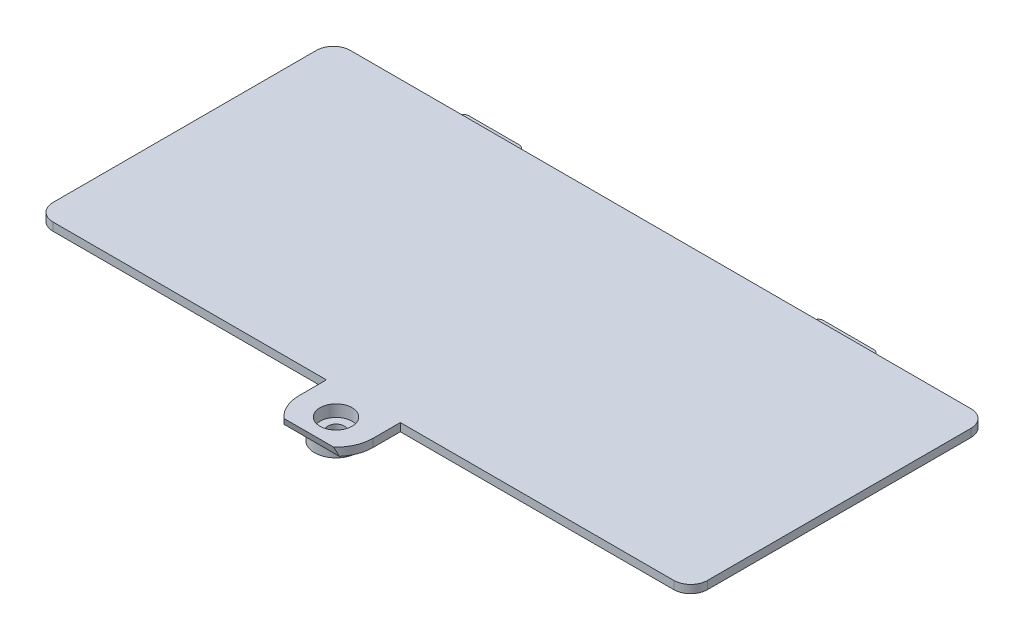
SolidWorks part; units mm, degrees
ref_plane "Plan de face" through (0, 0, 0) normal (0, 0, 1) x (1, 0, 0)
ref_plane "Plan de dessus" through (0, 0, 0) normal (0, 1, 0) x (1, 0, 0)
ref_plane "Plan de droite" through (0, 0, 0) normal (1, 0, 0) x (0, 0, -1)
sketch "Esquisse1" plane through (0, 0, 0) normal (0, 1, 0) x (1, 0, 0)
  line L0 (0, -16.1914) -> (0, 68.8201) construction
  line L1 (-24.9366, 0) -> (84.2046, 0) construction
  line L2 (-24.9366, 55.5) -> (84.2046, 55.5) construction
  line L3 (61.1, 68.8201) -> (61.1, -16.1914) construction
  line L4 (6.9, 12.8488) -> (6.9, -15.044) construction
  line L5 (22.2274, -5.1) -> (-43.2997, -5.1) construction
  line L6 (6.9, -5.1) -> (6.9, 0)
  line L7 (6.9, 0) -> (57.95, 0)
  line L8 (61.1, 3.15) -> (61.1, 52.35)
  line L9 (57.95, 55.5) -> (-57.95, 55.5)
  line L10 (-6.9, -5.1) -> (-6.9, 0)
  line L11 (-6.9, 0) -> (-57.95, 0)
  line L12 (-61.1, 3.15) -> (-61.1, 52.35)
  arc A0 (-6.9, -5.1) -> (6.9, -5.1) centre (0, -5.1) ccw
  arc A1 (61.1, 52.35) -> (57.95, 55.5) centre (57.95, 52.35) ccw
  arc A2 (57.95, 0) -> (61.1, 3.15) centre (57.95, 3.15) ccw
  arc A3 (-57.95, 0) -> (-61.1, 3.15) centre (-57.95, 3.15) cw
  arc A4 (-61.1, 52.35) -> (-57.95, 55.5) centre (-57.95, 52.35) cw
  circle A5 centre (0, -5.1) radius 1.5
  point P21 (61.1, 55.5)
  point P24 (61.1, 0)
  point P32 (0, 55.5)
  dimension "D2" = 61.1
  dimension "D4" = 3.15
  dimension "D5" = 6.9
  dimension "D1" = 5.1
  dimension "D3" = 55.5
extrude "Boss.-Extru.1" add sketch "Esquisse1" along normal blind 1.5
ref_plane "Plan1" through (0, 0, 0) normal (1, 0, 0) x (0, 0, -1)
sketch "Esquisse2" plane through (0, 0, 0) normal (0, -1, 0) x (1, 0, 0)
  line L0 (-61.1, -64.4737) -> (-61.1, 17.4142) construction
  line L1 (-69.9262, 0) -> (78.2262, 0) construction
  line L2 (-69.9262, -55.5) -> (78.2262, -55.5) construction
  line L3 (61.1, -64.4737) -> (61.1, 17.4142) construction
  line L4 (-59.1, 13.5084) -> (-59.1, -64.4737) construction
  line L5 (-69.9262, -52.2) -> (78.2262, -52.2) construction
  line L6 (78.2262, -2) -> (-69.9262, -2) construction
  line L7 (59.1, 13.5084) -> (59.1, -64.4737) construction
  line L8 (0, -63.5309) -> (0, 25.3606) construction
  line L9 (-15, 25.3606) -> (-15, -63.5309) construction
  line L10 (-16.5, -63.5309) -> (-16.5, 25.3606) construction
  line L11 (-46.5, 25.3606) -> (-46.5, -63.5309) construction
  line L12 (-48, 25.3606) -> (-48, -63.5309) construction
  line L13 (-69.9262, -27.1) -> (79.5731, -27.1) construction
  line L14 (68.6637, -11.35) -> (-69.9262, -11.35) construction
  line L15 (-69.9262, -9.85) -> (68.6637, -9.85) construction
  line L16 (68.6637, -26.35) -> (-69.9262, -26.35) construction
  line L17 (-59.1, -26.35) -> (-48, -26.35)
  line L18 (-48, -2) -> (-46.5, -2)
  line L19 (-48, -2) -> (-48, -9.85)
  line L20 (-48, -52.2) -> (-46.5, -52.2)
  line L21 (-46.5, -2) -> (-46.5, -9.85)
  line L22 (-16.5, -2) -> (-15, -2)
  line L23 (-16.5, -2) -> (-16.5, -9.85)
  line L24 (-16.5, -52.2) -> (-15, -52.2)
  line L25 (-15, -2) -> (-15, -9.85)
  line L26 (-59.1, -9.85) -> (-48, -9.85)
  line L27 (-59.1, -9.85) -> (-59.1, -11.35)
  line L28 (-59.1, -11.35) -> (-48, -11.35)
  line L29 (59.1, -9.85) -> (59.1, -11.35)
  line L30 (15, -2) -> (15, -9.85)
  line L31 (16.5, -52.2) -> (15, -52.2)
  line L32 (16.5, -2) -> (16.5, -9.85)
  line L33 (16.5, -2) -> (15, -2)
  line L34 (46.5, -2) -> (46.5, -9.85)
  line L35 (48, -52.2) -> (46.5, -52.2)
  line L36 (48, -2) -> (48, -9.85)
  line L37 (48, -2) -> (46.5, -2)
  line L38 (59.1, -44.35) -> (59.1, -42.85)
  line L39 (-59.1, -42.85) -> (-48, -42.85)
  line L40 (-59.1, -44.35) -> (-59.1, -42.85)
  line L41 (-59.1, -44.35) -> (-48, -44.35)
  line L42 (-59.1, -27.85) -> (-48, -27.85)
  line L43 (59.1, -26.35) -> (59.1, -27.85)
  line L44 (-59.1, -26.35) -> (-59.1, -27.85)
  line L45 (-46.5, -44.35) -> (-16.5, -44.35)
  line L46 (-48, -44.35) -> (-48, -52.2)
  line L47 (-46.5, -42.85) -> (-16.5, -42.85)
  line L48 (-46.5, -44.35) -> (-46.5, -52.2)
  line L49 (-46.5, -27.85) -> (-16.5, -27.85)
  line L50 (-48, -27.85) -> (-48, -42.85)
  line L51 (-46.5, -27.85) -> (-46.5, -42.85)
  line L52 (-46.5, -26.35) -> (-16.5, -26.35)
  line L53 (-46.5, -11.35) -> (-16.5, -11.35)
  line L54 (-48, -11.35) -> (-48, -26.35)
  line L55 (-46.5, -9.85) -> (-16.5, -9.85)
  line L56 (-46.5, -11.35) -> (-46.5, -26.35)
  line L57 (-15, -9.85) -> (15, -9.85)
  line L58 (-16.5, -11.35) -> (-16.5, -26.35)
  line L59 (-15, -11.35) -> (15, -11.35)
  line L60 (-15, -11.35) -> (-15, -26.35)
  line L61 (-15, -26.35) -> (15, -26.35)
  line L62 (-16.5, -27.85) -> (-16.5, -42.85)
  line L63 (-15, -27.85) -> (15, -27.85)
  line L64 (-15, -27.85) -> (-15, -42.85)
  line L65 (-16.5, -44.35) -> (-16.5, -52.2)
  line L66 (-15, -42.85) -> (15, -42.85)
  line L67 (-15, -44.35) -> (15, -44.35)
  line L68 (-15, -44.35) -> (-15, -52.2)
  line L69 (16.5, -44.35) -> (16.5, -52.2)
  line L70 (15, -44.35) -> (15, -52.2)
  line L71 (16.5, -42.85) -> (46.5, -42.85)
  line L72 (16.5, -44.35) -> (46.5, -44.35)
  line L73 (16.5, -27.85) -> (46.5, -27.85)
  line L74 (16.5, -27.85) -> (16.5, -42.85)
  line L75 (16.5, -26.35) -> (46.5, -26.35)
  line L76 (15, -27.85) -> (15, -42.85)
  line L77 (16.5, -11.35) -> (46.5, -11.35)
  line L78 (15, -11.35) -> (15, -26.35)
  line L79 (16.5, -9.85) -> (46.5, -9.85)
  line L80 (16.5, -11.35) -> (16.5, -26.35)
  line L81 (48, -9.85) -> (59.1, -9.85)
  line L82 (48, -11.35) -> (48, -26.35)
  line L83 (46.5, -11.35) -> (46.5, -26.35)
  line L84 (48, -11.35) -> (59.1, -11.35)
  line L85 (48, -27.85) -> (48, -42.85)
  line L86 (48, -26.35) -> (59.1, -26.35)
  line L87 (46.5, -27.85) -> (46.5, -42.85)
  line L88 (48, -27.85) -> (59.1, -27.85)
  line L89 (48, -44.35) -> (48, -52.2)
  line L90 (48, -42.85) -> (59.1, -42.85)
  line L91 (46.5, -44.35) -> (46.5, -52.2)
  line L92 (48, -44.35) -> (59.1, -44.35)
  dimension "D1" = 3.3
  dimension "D2" = 2
  dimension "D3" = 2
  dimension "D4" = 2
  dimension "D5" = 1.5
  dimension "D6" = 1.5
  dimension "D7" = 30
  dimension "D8" = 15
  dimension "D9" = 25.1
  dimension "D10" = 0.75
  dimension "D11" = 1.5
  dimension "D12" = 15
extrude "Boss.-Extru.2" add sketch "Esquisse2" along normal blind 1.5
fillet "Congé1" radius 1 14 edges at (47.25, -1.5, -52.2) (59.1, -1.5, -43.6) (59.1, -1.5, -27.1) (59.1, -1.5, -10.6) (47.25, -1.5, -2) (15.75, -1.5, -2) (15.75, -1.5, -52.2) (-15.75, -1.5, -2) (-47.25, -1.5, -2) (-59.1, -1.5, -10.6) (-59.1, -1.5, -27.1) (-59.1, -1.5, -43.6) (-15.75, -1.5, -52.2) (-47.25, -1.5, -52.2)
sketch "Esquisse4" plane through (0, 0, 0) normal (0, -1, 0) x (1, 0, 0)
  line L0 (0, -59.1586) -> (0, 14.6315) construction
  line L1 (57.95, -55.5) -> (-57.95, -55.5) construction
  line L2 (-41.9488, -57.5) -> (-24.9551, -57.5) construction
  line L3 (-41.9488, -51.5) -> (-24.9551, -51.5) construction
  line L4 (27.4, -51.5) -> (27.4, -56.5)
  line L5 (-38.8, -46.7046) -> (-38.8, -59.1586) construction
  line L6 (-27.4, -46.7046) -> (-27.4, -59.1586) construction
  line L7 (-38.8, -51.5) -> (-27.4, -51.5)
  line L8 (-38.8, -51.5) -> (-38.8, -56.5)
  line L9 (-37.8, -57.5) -> (-28.4, -57.5)
  line L10 (-27.4, -51.5) -> (-27.4, -56.5)
  line L11 (37.8, -57.5) -> (28.4, -57.5)
  line L12 (38.8, -51.5) -> (38.8, -56.5)
  line L13 (38.8, -51.5) -> (27.4, -51.5)
  arc A0 (-38.8, -56.5) -> (-37.8, -57.5) centre (-37.8, -56.5) ccw
  arc A1 (-28.4, -57.5) -> (-27.4, -56.5) centre (-28.4, -56.5) ccw
  arc A2 (28.4, -57.5) -> (27.4, -56.5) centre (28.4, -56.5) cw
  arc A3 (38.8, -56.5) -> (37.8, -57.5) centre (37.8, -56.5) cw
  point P24 (-27.4, -57.5)
  point P34 (27.4, -57.5)
  dimension "D3" = 1
  dimension "D1" = 4
  dimension "D2" = 6
extrude "Boss.-Extru.3" add sketch "Esquisse4" along normal blind 1.5
sketch "Esquisse6" plane through (0, 0, 0) normal (0, -1, 0) x (1, 0, 0)
  circle A0 centre (0, 5.1) radius 1.5
  circle A1 centre (0, 5.1) radius 4
extrude "Boss.-Extru.5" add sketch "Esquisse6" along normal blind 2.3
sketch "Esquisse7" plane through (0, 1.5, 0) normal (0, 1, 0) x (1, 0, 0)
  circle A0 centre (0, -5.1) radius 3
extrude "Enlèv. mat.-Extru.2" cut sketch "Esquisse7" against normal blind 2.2
fillet "Congé2" radius 1 2 edges at (33.1, -1.5, -51.5) (-33.1, -1.5, -51.5)
sketch "Esquisse9" plane through (0, 0, 0) normal (1, 0, 0) x (0, 0, -1)
  line L0 (-12, -1.8088) -> (-12, 2.9811) construction
  line L1 (-10.2, -4.8216) -> (-10.2, 2.9811) construction
  line L2 (-14.1404, 0) -> (-9.1812, 0) construction
  line L3 (-12, 0) -> (-5.1, 0) construction
  line L4 (-14.1404, 1.5) -> (-8.8596, 1.5) construction
  line L5 (-5.1, 1.5) -> (-12, 1.5) construction
  line L6 (-10.2, 1.5) -> (-7.8542, -4.945) construction
  line L7 (-9.654, 0) -> (-10.2, 1.5)
  line L8 (-10.2, 1.5) -> (-12.1262, 1.5)
  line L9 (-12.1262, 1.5) -> (-12.1262, 0)
  line L10 (-12.1262, 0) -> (-9.654, 0)
  dimension "D1" = 1.8
  dimension "D2" = 20
extrude "Enlèv. mat.-Extru.3" cut sketch "Esquisse9" against normal mid plane 12
